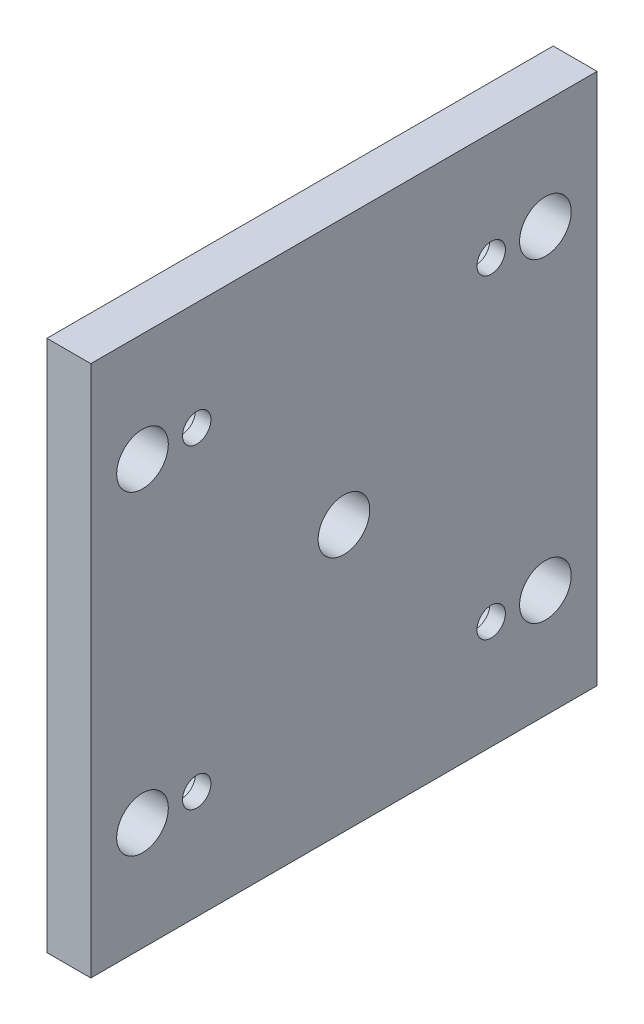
SolidWorks part; units mm, degrees
ref_plane "Face" through (0, 0, 0) normal (0, 0, 1) x (1, 0, 0)
ref_plane "Dessus" through (0, 0, 0) normal (0, 1, 0) x (1, 0, 0)
ref_plane "Droite" through (0, 0, 0) normal (1, 0, 0) x (0, 0, -1)
imported_body "Importée1"
sketch "Esquisse1" plane through (-161, 0, 0) normal (-1, 0, 0) x (0, 0, 1)
  circle A1 centre (98, 78) radius 45
  circle A2 centre (98, 78) radius 45
  dimension "D1" = 0
extrude "Extrusion1" add sketch "Esquisse1" along normal up to surface (4 mm away)
sketch "Esquisse2" plane through (-165, 0, 0) normal (-1, 0, 0) x (0, 0, 1)
  line L0 (0, 0) -> (0, 156) construction
  line L1 (196, 0) -> (0, 0) construction
  circle A0 centre (98, 78) radius 10
  dimension "D1" = 20
  dimension "D2" = 98
  dimension "D3" = 78
extrude "Enlèv. mat.-Extru.1" cut sketch "Esquisse2" against normal through all
sketch "Esquisse3" plane through (0, 156, 0) normal (0, 1, 0) x (-1, 0, 0)
  line L4 (148, 0) -> (165, 0)
  line L5 (165, 0) -> (165, 196)
  line L6 (165, 196) -> (148, 196)
  line L7 (148, 196) -> (148, 0)
  line L8 (148, 0) -> (165, 0)
  line L9 (165, 0) -> (165, 196)
  line L10 (165, 196) -> (148, 196)
  line L11 (148, 196) -> (148, 0)
  dimension "D1" = 0
extrude "Extrusion2" add sketch "Esquisse3" along normal blind 25
sketch "Esquisse4" plane through (0, 0, 0) normal (0, -1, 0) x (1, 0, 0)
  line L4 (-148, 196) -> (-165, 196)
  line L5 (-165, 196) -> (-165, 0)
  line L6 (-165, 0) -> (-148, 0)
  line L7 (-148, 0) -> (-148, 196)
  line L8 (-148, 196) -> (-165, 196)
  line L9 (-165, 196) -> (-165, 0)
  line L10 (-165, 0) -> (-148, 0)
  line L11 (-148, 0) -> (-148, 196)
  dimension "D1" = 0
extrude "Extrusion3" add sketch "Esquisse4" along normal blind 25
